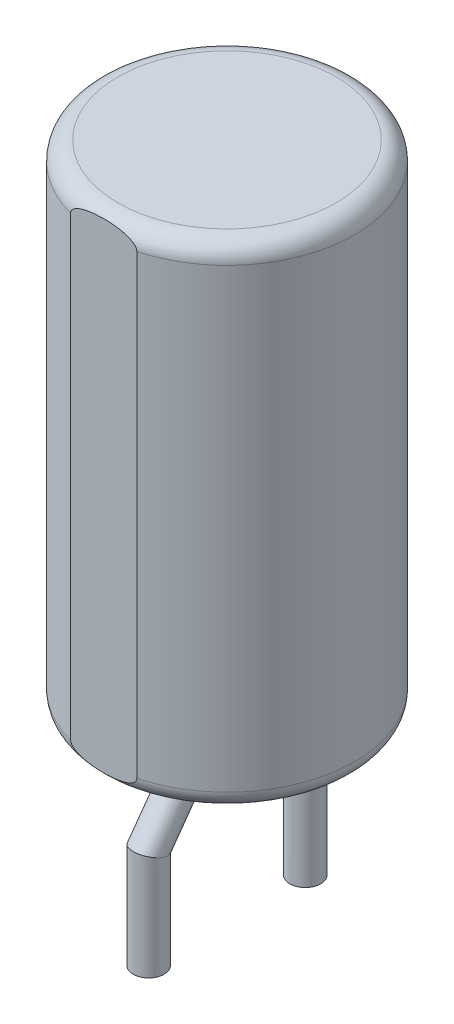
SolidWorks part; units mm, degrees
ref_plane "Plan de face" through (0, 0, 0) normal (0, 0, 1) x (1, 0, 0)
ref_plane "Plan de dessus" through (0, 0, 0) normal (0, 1, 0) x (1, 0, 0)
ref_plane "Plan de droite" through (0, 0, 0) normal (1, 0, 0) x (0, 0, -1)
sketch "Esquisse1" plane through (0, 0, 0) normal (0, 1, 0) x (1, 0, 0)
  circle A0 centre (0, 0) radius 2.07
  dimension "D1" = 4.14
extrude "Extrusion1" add sketch "Esquisse1" along normal blind 8
fillet "Congé1" radius 0.3 2 edges at (0, 0, 2.07) (0, 8, 2.07)
sketch "Esquisse2" plane through (0, 8, 0) normal (0, 1, 0) x (-1, 0, 0)
  line L1 (-0.5369, 1.9991) -> (0.5773, 1.9991)
  line L2 (-0.5369, 1.9991) -> (-0.5369, 2.1549)
  line L3 (-0.5369, 2.1549) -> (0.5773, 2.1549)
  line L4 (0.5773, 1.9991) -> (0.5773, 2.1549)
  circle A0 centre (0, 0) radius 2.07 construction
extrude "Enlèv. mat.-Extru.1" cut sketch "Esquisse2" against normal through all
sketch "Esquisse3" plane through (0, 0, 0) normal (0, -1, 0) x (1, 0, 0)
  circle A0 centre (0, -0.794) radius 0.2501
sketch "Esquisse4" plane through (0, 0, 0) normal (1, 0, 0) x (0, 0, -1)
  line L0 (0, 0) -> (0, -2.5233) construction
  line L1 (0.794, 0) -> (0.794, -0.6556)
  line L2 (-1.77, 0) -> (1.77, 0) construction
  line L3 (0.794, -0.6556) -> (1.27, -1.3171)
  line L4 (1.27, -1.3171) -> (1.27, -2.9612)
  dimension "D1" = 1.27
sweep "Balayage1" add profiles "Esquisse3" path "Esquisse4"
mirror "Symétrie1" about plane through (0, 0, 0) normal (0, 0, 1) of "Balayage1"
